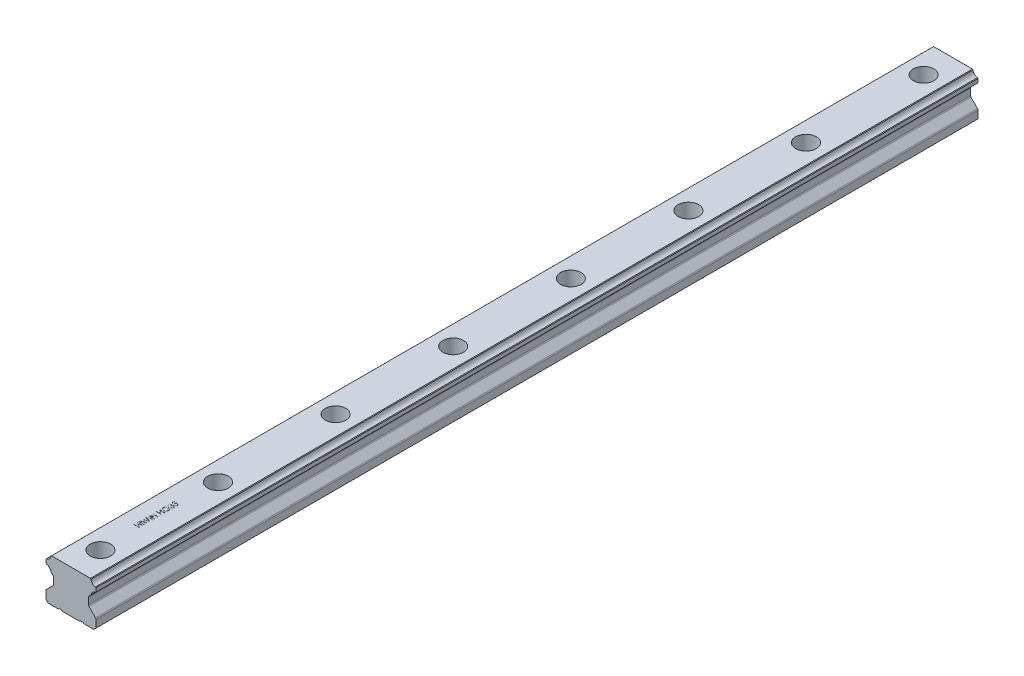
SolidWorks part; units mm, degrees
ref_plane "前视基准面" through (0, 0, 0) normal (0, 0, 1) x (1, 0, 0)
ref_plane "上视基准面" through (0, 0, 0) normal (0, 1, 0) x (1, 0, 0)
ref_plane "右视基准面" through (0, 0, 0) normal (1, 0, 0) x (0, 0, -1)
sketch "草图1" plane through (0, 0, 0) normal (0, 0, 1) x (1, 0, 0)
  line L28 (-12.2515, 11.8899) -> (-16.6485, 7.4929)
  line L29 (13.2514, 29) -> (-13.2514, 29)
  line L30 (-5.85, 0) -> (5.85, 0)
  line L31 (12.2515, 17.9901) -> (13.6259, 19.3645)
  line L32 (-17, 25.2514) -> (-17, 22.7386)
  line L33 (17, 25.2514) -> (16.6226, 25.6288)
  line L34 (-8.75, 0) -> (-8.25, 0.5)
  line L35 (8.75, 0) -> (15.5, 0)
  line L36 (16.6345, 22.3731) -> (17, 22.7386)
  line L37 (-8.25, 0.5) -> (-6.35, 0.5)
  line L38 (6.35, 0.5) -> (8.25, 0.5)
  line L39 (-15.5, 0) -> (-8.75, 0)
  line L40 (5.85, 0) -> (6.35, 0.5)
  line L41 (13.6268, 28.6246) -> (13.2514, 29)
  line L42 (-17, 1.5) -> (-15.5, 0)
  line L43 (-16.6226, 25.6288) -> (-17, 25.2514)
  line L44 (-11.9, 17.1415) -> (-11.9, 12.7385)
  line L45 (-6.35, 0.5) -> (-5.85, 0)
  line L46 (17, 22.7386) -> (17, 25.2514)
  line L47 (17, 1.5) -> (17, 6.6443)
  line L48 (16.6485, 7.4929) -> (12.2515, 11.8899)
  line L49 (-13.2514, 29) -> (-13.6268, 28.6246)
  line L50 (-17, 22.7386) -> (-16.6345, 22.3731)
  line L51 (-13.6259, 19.3645) -> (-12.2515, 17.9901)
  line L52 (8.25, 0.5) -> (8.75, 0)
  line L53 (15.5, 0) -> (17, 1.5)
  line L54 (11.9, 12.7385) -> (11.9, 17.1415)
  line L55 (-17, 6.6443) -> (-17, 1.5)
  arc A10 (-11.9, 17.1415) -> (-12.2515, 17.9901) centre (-13.1, 17.1415) ccw
  arc A11 (11.9, 12.7385) -> (12.2515, 11.8899) centre (13.1, 12.7385) ccw
  arc A12 (16.6345, 22.3731) -> (13.6259, 19.3645) centre (16.8676, 19.1314) ccw
  arc A13 (17, 6.6443) -> (16.6485, 7.4929) centre (15.8, 6.6443) ccw
  arc A14 (-16.6226, 25.6288) -> (-13.6268, 28.6246) centre (-16.8676, 28.8696) ccw
  arc A15 (-12.2515, 11.8899) -> (-11.9, 12.7385) centre (-13.1, 12.7385) ccw
  arc A16 (-16.6485, 7.4929) -> (-17, 6.6443) centre (-15.8, 6.6443) ccw
  arc A17 (-13.6259, 19.3645) -> (-16.6345, 22.3731) centre (-16.8676, 19.1314) ccw
  arc A18 (13.6268, 28.6246) -> (16.6226, 25.6288) centre (16.8676, 28.8696) ccw
  arc A19 (12.2515, 17.9901) -> (11.9, 17.1415) centre (13.1, 17.1415) ccw
extrude "凸台-拉伸1" add sketch "草图1" against normal blind 600
hole_wizard "M8 六角凹头螺钉的柱形沉头孔1" positions "草图3" profile "草图2" counterbore size "M8" standard "ISO"
sketch "草图3" plane through (-5.4771, 29, -56.1162) normal (0, 1, 0) x (-1, 0, 0)
  point P0 (-5.4771, 36.1162)
  dimension "D1" = 20
sketch "草图2" plane through (0, 29, -20) normal (1, 0, 0) x (0, 0, 1)
  line L0 (0, 0) -> (0, 29)
  line L1 (0, 29) -> (4.5, 29)
  line L3 (4.5, 29) -> (4.5, 12)
  line L4 (4.5, 12) -> (7, 12)
  line L5 (7, 12) -> (7, 0)
  line L7 (7, 0) -> (0, 0)
  line L11 (0, -6.35) -> (0, 107.95) construction
  dimension "通孔孔直径" = 9
  dimension "通孔孔深度" = 29
  dimension "柱形沉头孔直径" = 14
  dimension "柱形沉头孔深度" = 12
pattern_linear "阵列(线性)1" count 8 spacing 80 along (0, 0, -1) of "M8 六角凹头螺钉的柱形沉头孔1"
sketch "草图6" plane through (0, 29, 0) normal (0, 1, 0) x (1, 0, 0)
  line L0 (0, 20) -> (0, 100) construction
  text T0 "HIWIN HG35"
extrude "切除-拉伸1" cut sketch "草图6" against normal blind 0.1
equation "\"D1@凸台-拉伸1\" = 2 * \"D1@草图3\" + \"D3@阵列(线性)1\" *  ( \"D1@阵列(线性)1\"  - 1) "
